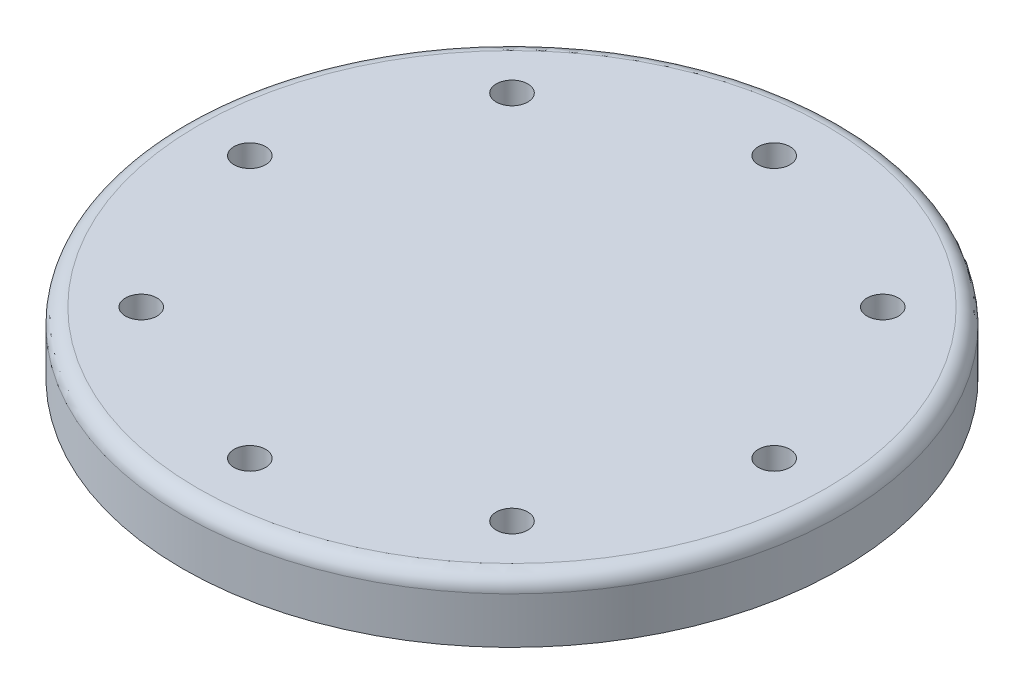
SolidWorks part; units mm, degrees
ref_plane "Front Plane" through (0, 0, 0) normal (0, 0, 1) x (1, 0, 0)
ref_plane "Top Plane" through (0, 0, 0) normal (0, 1, 0) x (1, 0, 0)
ref_plane "Right Plane" through (0, 0, 0) normal (1, 0, 0) x (0, 0, -1)
sketch "Sketch1" plane through (0, 0, 0) normal (0, 1, 0) x (1, 0, 0)
  line L0 (0, -40.4112) -> (-40.4112, 0) construction
  line L1 (-28.575, 28.575) -> (28.575, 28.575) construction
  line L2 (-28.575, 28.575) -> (-28.575, -28.575) construction
  line L3 (-28.575, -28.575) -> (28.575, -28.575) construction
  line L4 (28.575, 28.575) -> (28.575, -28.575) construction
  line L5 (-28.575, 28.575) -> (28.575, -28.575) construction
  line L6 (-28.575, -28.575) -> (28.575, 28.575) construction
  line L7 (0, -40.4112) -> (40.4112, 0) construction
  line L8 (-40.4112, 0) -> (0, 40.4112) construction
  line L9 (40.4112, 0) -> (0, 40.4112) construction
  line L10 (0, -40.4112) -> (0, 40.4112) construction
  line L11 (-40.4112, 0) -> (40.4112, 0) construction
  circle A0 centre (0, 0) radius 50.8
  circle A1 centre (-28.575, 28.575) radius 2.4312
  circle A2 centre (-28.575, -28.575) radius 2.4312
  circle A3 centre (28.575, -28.575) radius 2.4312
  circle A4 centre (28.575, 28.575) radius 2.4312
  circle A5 centre (0, 40.4112) radius 2.4312
  circle A6 centre (-40.4112, 0) radius 2.4313
  circle A7 centre (0, -40.4112) radius 2.4312
  circle A8 centre (40.4112, 0) radius 2.4313
  dimension "D1" = 4.8625
  dimension "D4" = 101.6
  dimension "D7" = 4.8625
  dimension "D2" = 57.15
  dimension "D3" = 57.15
  dimension "D5" = 45
  dimension "D6" = 57.15
extrude "Boss-Extrude1" add sketch "Sketch1" along normal blind 9.525
sketch "Sketch2" plane through (0, 0, 0) normal (0, -1, 0) x (1, 0, 0)
  circle A0 centre (-28.575, 28.575) radius 4.7625
  circle A1 centre (28.575, 28.575) radius 4.7625
  circle A2 centre (-28.575, -28.575) radius 4.7625
  circle A3 centre (28.575, -28.575) radius 4.7625
  dimension "D1" = 9.525
extrude "Cut-Extrude1" cut sketch "Sketch2" against normal blind 4.7625
fillet "Fillet1" radius 2.3813 1 edges at (0, 9.525, 50.8)
